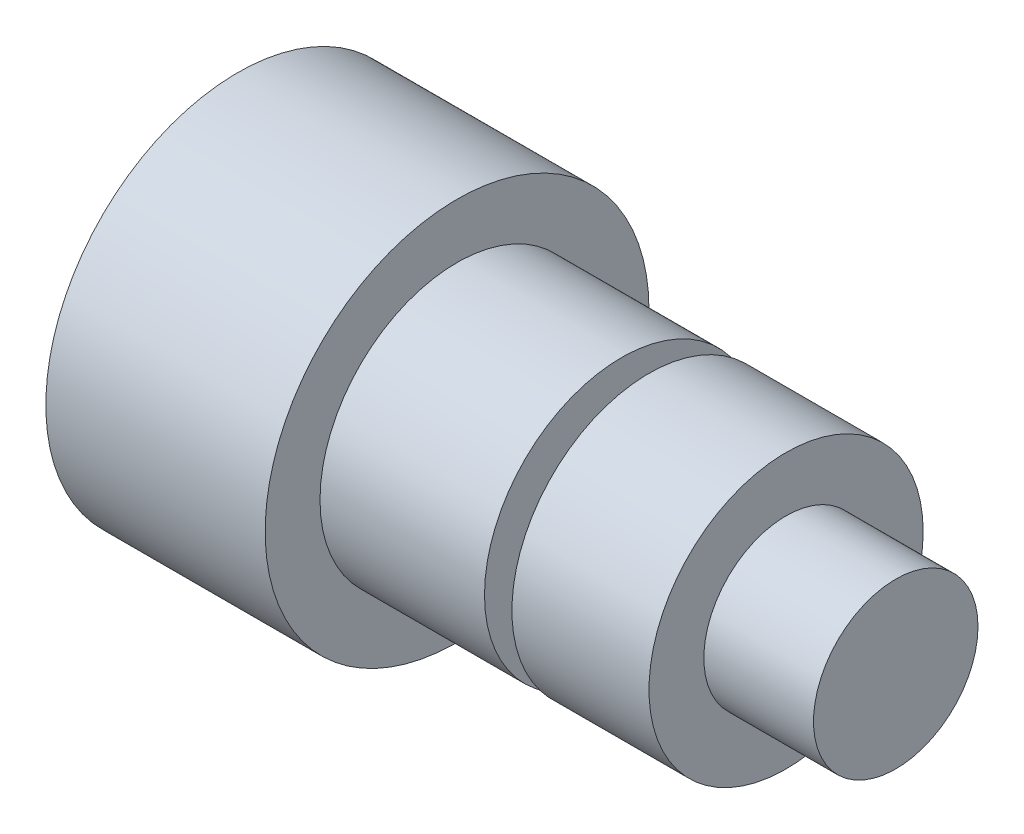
SolidWorks part; units mm, degrees
ref_plane "Plane1" through (0, 0, 0) normal (0, 0, 1) x (1, 0, 0)
ref_plane "Plane2" through (0, 0, 0) normal (0, 1, 0) x (1, 0, 0)
ref_plane "Plane3" through (0, 0, 0) normal (1, 0, 0) x (0, 0, -1)
sketch "Sketch1" plane through (0, 0, 0) normal (1, 0, 0) x (0, 0, -1)
  circle A0 centre (0, 0) radius 44.45
  dimension "D1" = 88.9
extrude "Base-Extrude" add sketch "Sketch1" along normal blind 50.8
sketch "Sketch2" plane through (50.8, 0, 0) normal (1, 0, 0) x (0, 0, -1)
  circle A0 centre (0, 0) radius 31.75
  dimension "D1" = 63.5
extrude "Boss-Extrude1" add sketch "Sketch2" along normal blind 38.1
sketch "Sketch3" plane through (88.9, 0, 0) normal (1, 0, 0) x (0, 0, -1)
  circle A0 centre (0, 0) radius 22.225
  circle A1 centre (0, 0) radius 31.75 construction
  dimension "D1" = 44.45
extrude "Boss-Extrude2" add sketch "Sketch3" along normal blind 6.35
sketch "Sketch4" plane through (95.25, 0, 0) normal (1, 0, 0) x (0, 0, -1)
  circle A0 centre (0, 0) radius 31.75
  circle A1 centre (0, 0) radius 31.75 construction
extrude "Boss-Extrude3" add sketch "Sketch4" along normal blind 31.75
sketch "Sketch5" plane through (127, 0, 0) normal (1, 0, 0) x (0, 0, -1)
  circle A0 centre (0, 0) radius 19.05
  dimension "D1" = 38.1
extrude "Boss-Extrude4" add sketch "Sketch5" along normal blind 25.4
